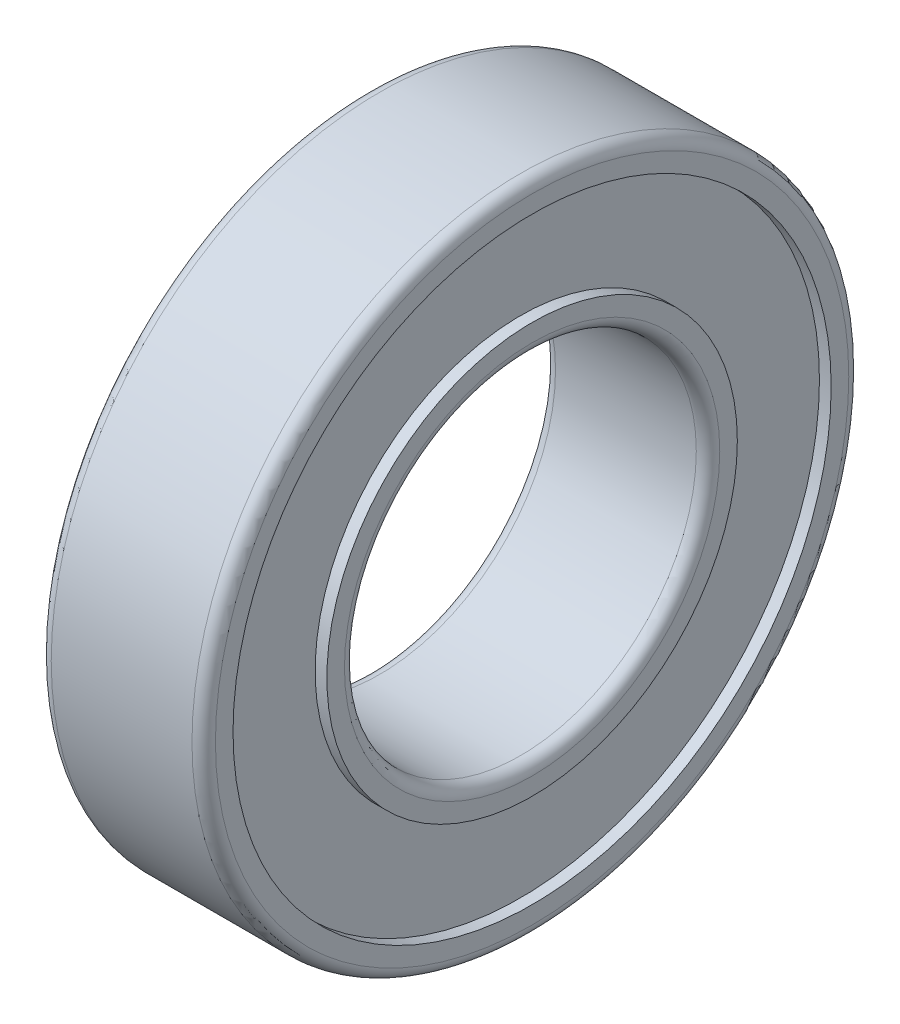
SolidWorks part; units mm, degrees
other "<217-2742-001 Rev4>-<Imported1>"
ref_plane "Front Plane" through (0, 0, 0) normal (0, 0, 1) x (1, 0, 0)
ref_plane "Top Plane" through (0, 0, 0) normal (0, 1, 0) x (1, 0, 0)
ref_plane "Right Plane" through (0, 0, 0) normal (1, 0, 0) x (0, 0, -1)
mirrored part "217-2742-001 Rev4_Mirrored"
